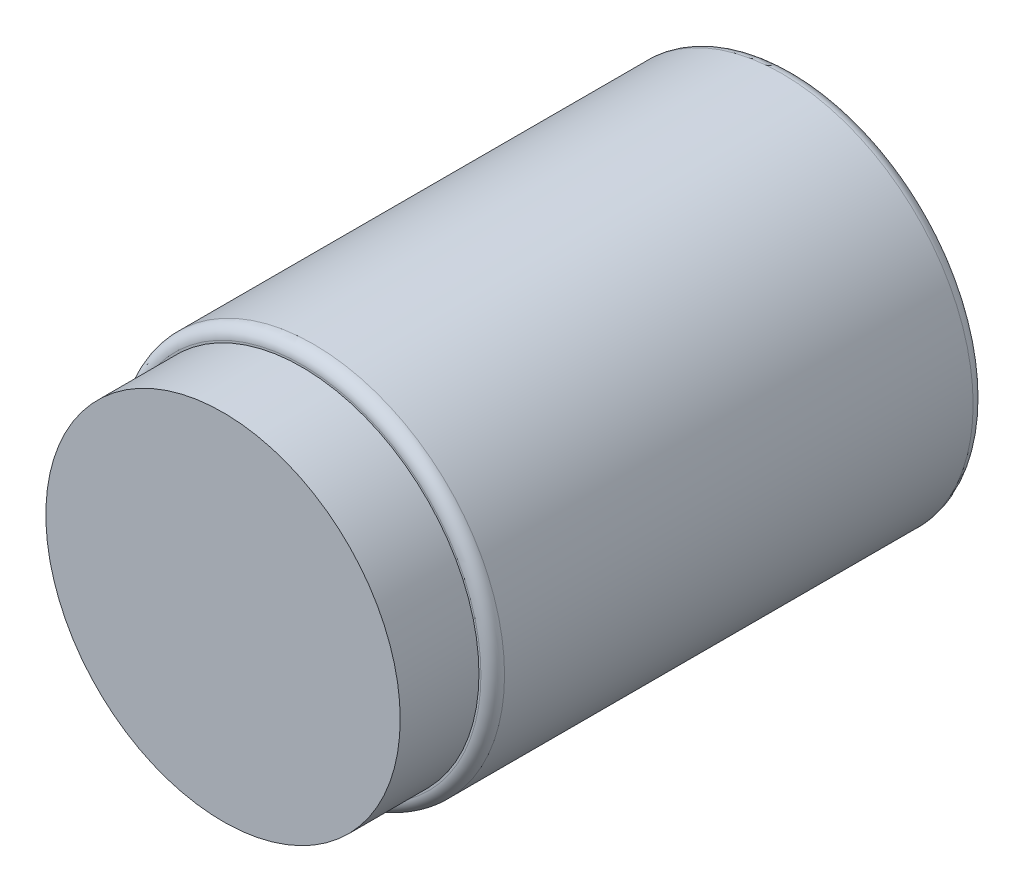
SolidWorks part; units mm, degrees
ref_plane "Plan de face" through (0, 0, 0) normal (0, 0, 1) x (1, 0, 0)
ref_plane "Plan de dessus" through (0, 0, 0) normal (0, 1, 0) x (1, 0, 0)
ref_plane "Plan de droite" through (0, 0, 0) normal (1, 0, 0) x (0, 0, -1)
sketch "Esquisse1" plane through (0, 0, 0) normal (0, 0, 1) x (1, 0, 0)
  circle A0 centre (0, 0) radius 48.5
  dimension "D1" = 97
extrude "Extrusion1" add sketch "Esquisse1" along normal blind 125
sketch "Esquisse2" plane through (0, 0, 125) normal (0, 0, 1) x (1, 0, 0)
  circle A0 centre (0, 0) radius 45
  dimension "D1" = 90
extrude "Extrusion2" add sketch "Esquisse2" along normal blind 20
fillet "Congé1" radius 3 1 edges at (48.5, 0, 0)
fillet "Congé2" radius 3 1 edges at (48.5, 0, 125)
sketch "Esquisse3" plane through (0, 0, 0) normal (0, 0, -1) x (-1, 0, 0)
  circle A0 centre (0, 0) radius 15
  dimension "D1" = 30
extrude "Extrusion3" add sketch "Esquisse3" along normal blind 5
sketch "Esquisse4" plane through (0, 0, 0) normal (0, 1, 0) x (1, 0, 0)
  circle A0 centre (0, 15) radius 15
  dimension "D1" = 30
extrude "Enlèv. mat.-Extru.1" cut sketch "Esquisse4" along normal through all and the other way through all
